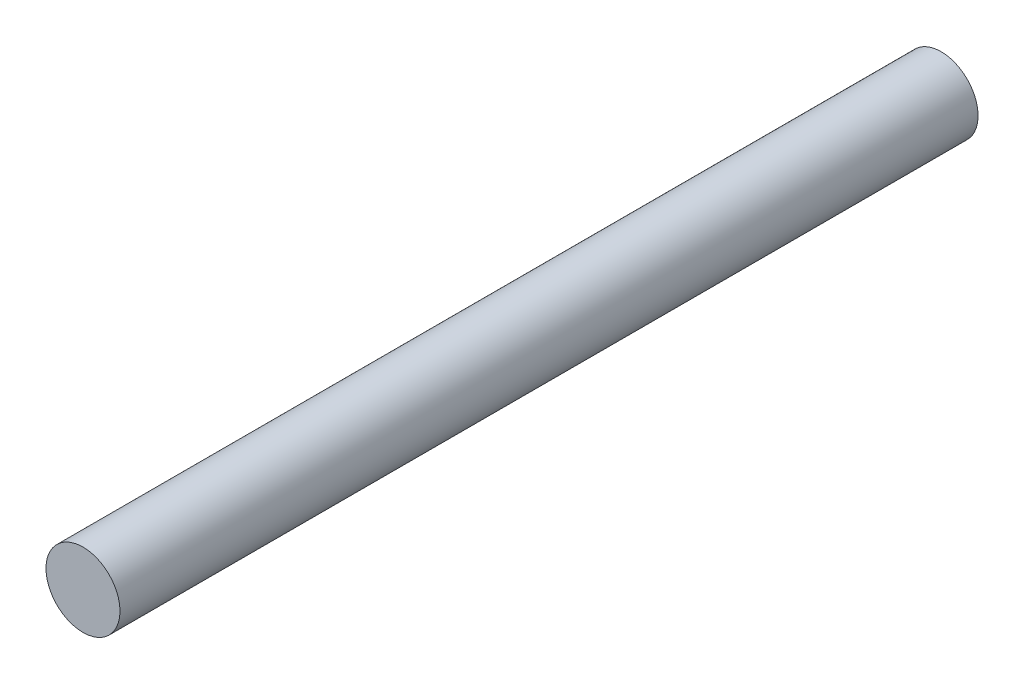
SolidWorks part; units mm, degrees
ref_plane "Face" through (0, 0, 0) normal (0, 0, 1) x (1, 0, 0)
ref_plane "Dessus" through (0, 0, 0) normal (0, 1, 0) x (1, 0, 0)
ref_plane "Droite" through (0, 0, 0) normal (1, 0, 0) x (0, 0, -1)
sketch "Esquisse1" plane through (0, 0, 0) normal (0, 0, 1) x (1, 0, 0)
  circle A0 centre (0, 0) radius 1.25
  dimension "D1" = 2.5
extrude "Base-Extrusion" add sketch "Esquisse1" along normal blind 29
